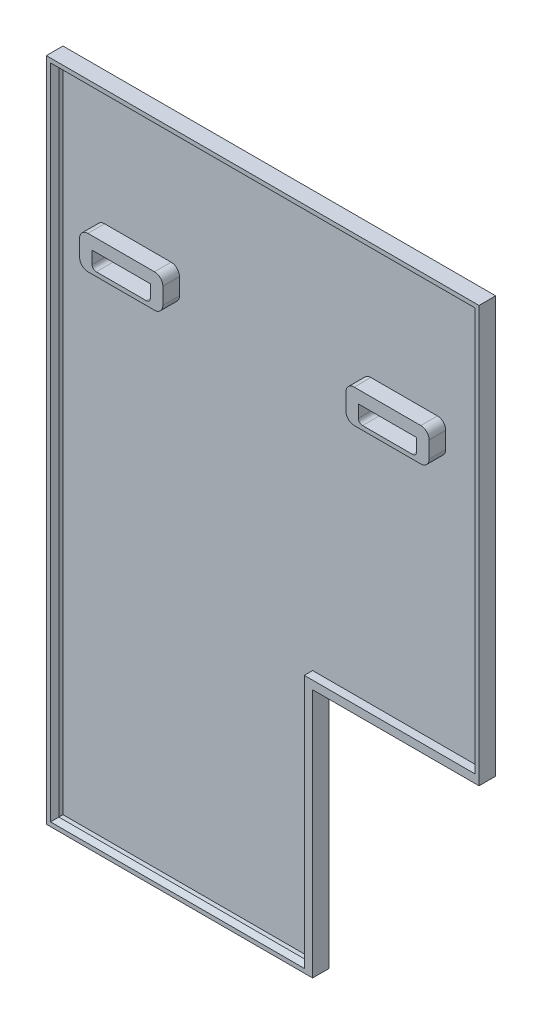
SolidWorks part; units mm, degrees
ref_plane "前基準面" through (0, 0, 0) normal (0, 0, 1) x (1, 0, 0)
ref_plane "上基準面" through (0, 0, 0) normal (0, 1, 0) x (1, 0, 0)
ref_plane "右基準面" through (0, 0, 0) normal (1, 0, 0) x (0, 0, -1)
sketch "草圖1" plane through (0, 0, 0) normal (0, 0, 1) x (1, 0, 0)
  line L1 (0, 0) -> (520, 0)
  line L2 (0, 0) -> (0, -800)
  line L3 (0, -800) -> (320, -800)
  line L4 (520, 0) -> (520, -500)
  line L6 (320, -800) -> (320, -500)
  line L7 (320, -500) -> (520, -500)
  dimension "D1" = 520
  dimension "D2" = 800
  dimension "D3" = 300
  dimension "D4" = 200
extrude "填料-伸長1" add sketch "草圖1" along normal blind 20
shell "薄殼2" thickness 10
shell "薄殼4" thickness 10
chamfer "導角1" distance 5 angle 45 4 edges at (160, -790, 20) (510, -250, 20) (10, -400, 20) (260, -10, 20)
sketch "草圖2" plane through (0, 0, 10) normal (0, 0, 1) x (1, 0, 0)
  line L0 (0, 0) -> (0, -800) construction
  line L1 (60, -150) -> (140, -150)
  line L2 (50, -160) -> (50, -180)
  line L3 (60, -190) -> (140, -190)
  line L4 (150, -160) -> (150, -180)
  line L5 (380, -150) -> (460, -150)
  line L6 (370, -160) -> (370, -180)
  line L7 (380, -190) -> (460, -190)
  line L8 (470, -160) -> (470, -180)
  line L9 (520, 0) -> (0, 0) construction
  arc A0 (150, -180) -> (140, -190) centre (140, -180) cw
  arc A1 (150, -160) -> (140, -150) centre (140, -160) ccw
  arc A2 (50, -180) -> (60, -190) centre (60, -180) ccw
  arc A3 (60, -150) -> (50, -160) centre (60, -160) ccw
  arc A4 (470, -180) -> (460, -190) centre (460, -180) cw
  arc A5 (470, -160) -> (460, -150) centre (460, -160) ccw
  arc A6 (370, -180) -> (380, -190) centre (380, -180) ccw
  arc A7 (370, -160) -> (380, -150) centre (380, -160) cw
  point P16 (150, -150)
  point P19 (50, -190)
  point P22 (50, -150)
  point P27 (470, -150)
  point P30 (370, -190)
  point P33 (370, -150)
  dimension "D8" = 10
  dimension "D9" = 10
  dimension "D1" = 100
  dimension "D2" = 100
  dimension "D3" = 40
  dimension "D4" = 40
  dimension "D5" = 320
  dimension "D6" = 50
  dimension "D7" = 150
extrude "填料-伸長2" add sketch "草圖2" along normal blind 20
sketch "草圖3" plane through (0, 0, 30) normal (0, 0, 1) x (1, 0, 0)
  line L0 (50, -160) -> (50, -180) construction
  line L1 (65, -165) -> (135, -165)
  line L2 (65, -165) -> (65, -180)
  line L3 (70, -185) -> (130, -185)
  line L4 (135, -165) -> (135, -180)
  line L5 (385, -165) -> (455, -165)
  line L6 (385, -165) -> (385, -180)
  line L7 (390, -185) -> (450, -185)
  line L8 (455, -165) -> (455, -180)
  line L9 (370, -160) -> (370, -180) construction
  line L10 (140, -150) -> (60, -150) construction
  line L11 (460, -150) -> (380, -150) construction
  arc A0 (455, -180) -> (450, -185) centre (450, -180) cw
  arc A1 (385, -180) -> (390, -185) centre (390, -180) ccw
  arc A2 (135, -180) -> (130, -185) centre (130, -180) cw
  arc A3 (65, -180) -> (70, -185) centre (70, -180) ccw
  point P21 (385, -185)
  point P26 (65, -185)
  dimension "D9" = 5
  dimension "D1" = 70
  dimension "D2" = 70
  dimension "D3" = 20
  dimension "D4" = 20
  dimension "D5" = 15
  dimension "D6" = 15
  dimension "D7" = 15
  dimension "D8" = 15
extrude "除料-伸長1" cut sketch "草圖3" against normal blind 20
